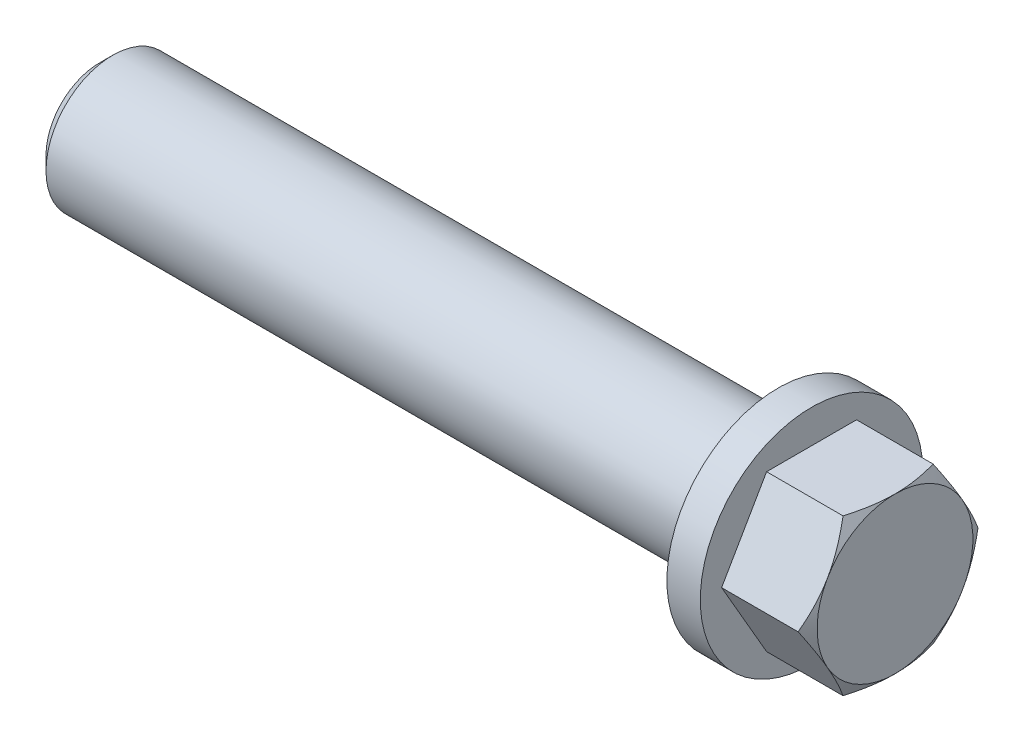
SolidWorks part; units mm, degrees
ref_plane "Face" through (0, 0, 0) normal (0, 0, 1) x (1, 0, 0)
ref_plane "Dessus" through (0, 0, 0) normal (0, 1, 0) x (1, 0, 0)
ref_plane "Droite" through (0, 0, 0) normal (1, 0, 0) x (0, 0, -1)
sketch "Esquisse1" plane through (0, 0, 0) normal (1, 0, 0) x (0, 0, -1)
  line L0 (8.0829, 0) -> (4.0415, 7)
  line L1 (4.0415, 7) -> (-4.0415, 7)
  line L2 (-4.0415, 7) -> (-8.0829, 0)
  line L3 (-8.0829, 0) -> (-4.0415, -7)
  line L4 (-4.0415, -7) -> (4.0415, -7)
  line L5 (4.0415, -7) -> (8.0829, 0)
  line L6 (0, 0) -> (31, 0) construction
  circle A0 centre (0, 0) radius 8.0829 construction
  dimension "D1" = 14
extrude "Base-Extrusion" add sketch "Esquisse1" along normal blind 7.5
sketch "Esquisse2" plane through (0, 0, 0) normal (-1, 0, 0) x (0, 0, 1)
  circle A0 centre (0, 0) radius 6
  dimension "D1" = 12
extrude "Boss.-Extru.1" add sketch "Esquisse2" along normal blind 64
sketch "Esquisse3" plane through (0, 0, 0) normal (0, 0, 1) x (1, 0, 0)
  line L0 (7.5, -7) -> (0, -19.9904)
  line L1 (0, -19.9904) -> (7.5, -19.9904)
  line L2 (7.5, -19.9904) -> (7.5, -7)
  line L3 (3.75, -13.4952) -> (7.5, -19.9904) construction
  line L4 (0, 0) -> (0, -7) construction
  line L5 (0, 0) -> (12.7759, 0) construction
  line L6 (-64, 0) -> (0, 0) construction
revolve "Enlèvement de matière-Révolution1" cut sketch "Esquisse3" angle 360 about L5
chamfer "Chanfrein1" distance 1.2 angle 45 1 edges at (-64, 0, 6)
sketch "Esquisse4" plane through (0, 0, 0) normal (0, 0, 1) x (1, 0, 0)
  line L0 (0, 0) -> (-110.7549, 0) construction
  line L2 (0, 0) -> (-3, 0)
  line L3 (0, 0) -> (0, 10)
  line L4 (0, 10) -> (-3, 10)
  line L5 (-3, 0) -> (-3, 10)
  dimension "D1" = 3
  dimension "D2" = 20
revolve "Révolution1" add sketch "Esquisse4" angle 360 about L0
sketch "Esquisse5" plane through (0, 0, 0) normal (0, 0, 1) x (1, 0, 0)
  line L0 (-3, 6) -> (-3, -6) construction
  line L1 (-3, 0) -> (-37, 0)
  line L2 (-3, 0) -> (-3, 6)
  line L3 (-3, 6) -> (-37, 6)
  line L4 (-37, 0) -> (-37, 6)
  line L5 (0, 0) -> (-308.1157, 0) construction
  dimension "D1" = 12
  dimension "D2" = 34
revolve "Révolution2" add sketch "Esquisse5" angle 360 about L5
fillet "Congé1" radius 1
equation "\"D2@Représentation de filetage1\" = 0.8*\"D1@Esquisse2\""
equation "\"D1@Chanfrein1\" = 0.1*\"D1@Esquisse2\""
